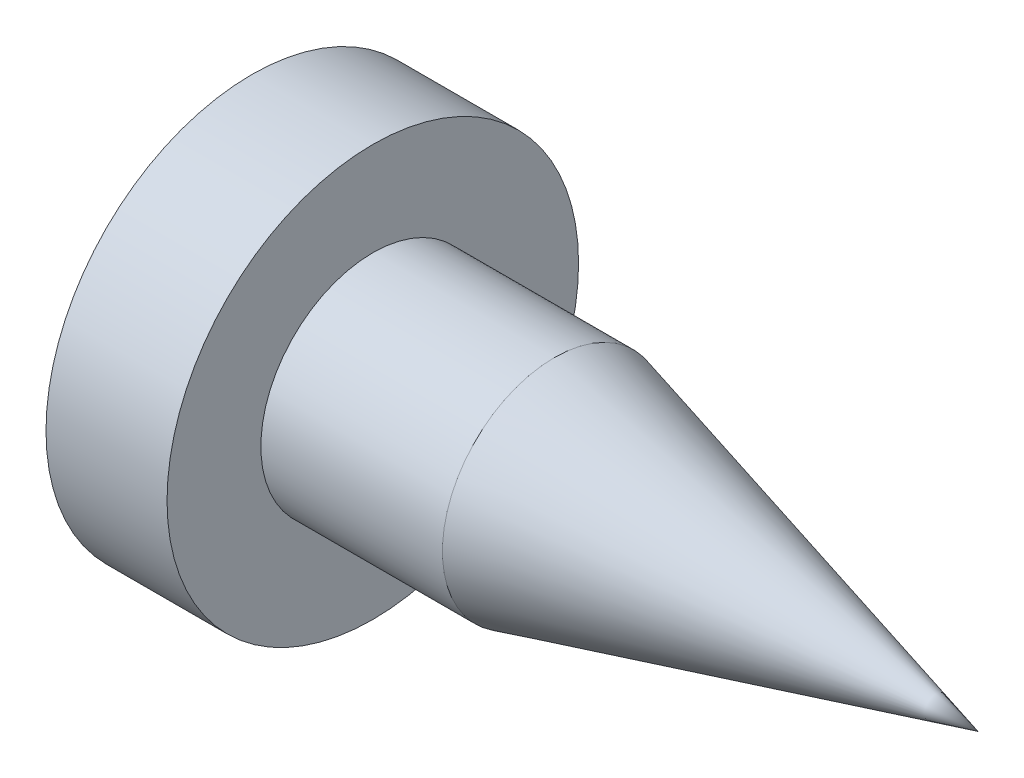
SolidWorks part; units mm, degrees
ref_plane "Plan1" through (0, 0, 0) normal (0, 0, 1) x (1, 0, 0)
ref_plane "Plan2" through (0, 0, 0) normal (0, 1, 0) x (1, 0, 0)
ref_plane "Plan3" through (0, 0, 0) normal (1, 0, 0) x (0, 0, -1)
sketch "Esquisse1" plane through (0, 0, 0) normal (0, 0, 1) x (1, 0, 0)
  line L0 (0, 1.85) -> (3, 1.85)
  line L1 (3, 1.85) -> (10, 0)
  line L2 (10, 0) -> (-3, 0)
  line L3 (-2, 0) -> (9, 0) construction
  line L4 (-2, 3.4) -> (0, 3.4)
  line L5 (0, 3.4) -> (0, 1.85)
  arc A0 (-2, 3.4) -> (-3, 0) centre (3.28, 0) ccw
  dimension "D1" = 1.85
  dimension "D2" = 10
  dimension "D3" = 3
  dimension "D4" = 2
  dimension "D5" = 3
  dimension "D6" = 3.4
revolve "Base-Révolution" add sketch "Esquisse1" angle 360 about L3
ref_plane "Plan4" through (-1, 0, 0) normal (1, 0, 0) x (0, 0, -1)
sketch "Esquisse2" plane through (-1, 0, 0) normal (1, 0, 0) x (0, 0, -1)
  line L0 (0.7, -0.5) -> (2, -0.5)
  line L1 (-2, -0.5) -> (-0.7, -0.5)
  line L2 (-2, -0.5) -> (-2, 0.5)
  line L3 (-2, 0.5) -> (-0.7, 0.5)
  line L4 (2, -0.5) -> (2, 0.5)
  line L5 (-0.5, -2) -> (0.5, -2)
  line L6 (-0.5, -2) -> (-0.5, -0.7)
  line L7 (-0.5, 2) -> (0.5, 2)
  line L8 (0.5, -2) -> (0.5, -0.7)
  line L9 (-0.5, 0.7) -> (-0.5, 2)
  line L10 (0.7, 0.5) -> (2, 0.5)
  line L11 (0.5, 0.7) -> (0.5, 2)
  arc A0 (-0.7, -0.5) -> (-0.5, -0.7) centre (-0.7, -0.7) cw
  arc A1 (-0.5, 0.7) -> (-0.7, 0.5) centre (-0.7, 0.7) cw
  arc A2 (0.7, 0.5) -> (0.5, 0.7) centre (0.7, 0.7) cw
  arc A3 (0.5, -0.7) -> (0.7, -0.5) centre (0.7, -0.7) cw
  point P19 (0.5, 0.5)
  dimension "D9" = 0.2
  dimension "D1" = 4
  dimension "D2" = 4
  dimension "D3" = 0.5
  dimension "D4" = 1
  dimension "D5" = 0.5
  dimension "D6" = 1
  dimension "D7" = 2
  dimension "D8" = 2
extrude "Enlèv. mat.-Extru.1" cut sketch "Esquisse2" against normal blind 10
